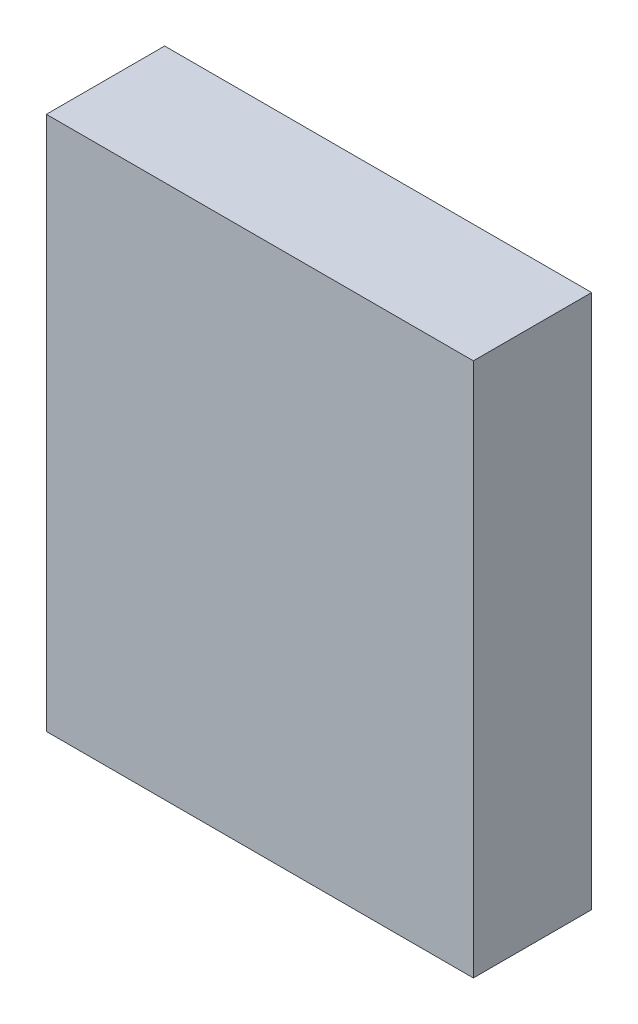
SolidWorks part; units mm, degrees
ref_plane "Front Plane" through (0, 0, 0) normal (0, 0, 1) x (1, 0, 0)
ref_plane "Top Plane" through (0, 0, 0) normal (0, 1, 0) x (1, 0, 0)
ref_plane "Right Plane" through (0, 0, 0) normal (1, 0, 0) x (0, 0, -1)
sketch "Sketch1"
extrude "Extrude1" add sketch "Sketch1" along normal blind 19.05
